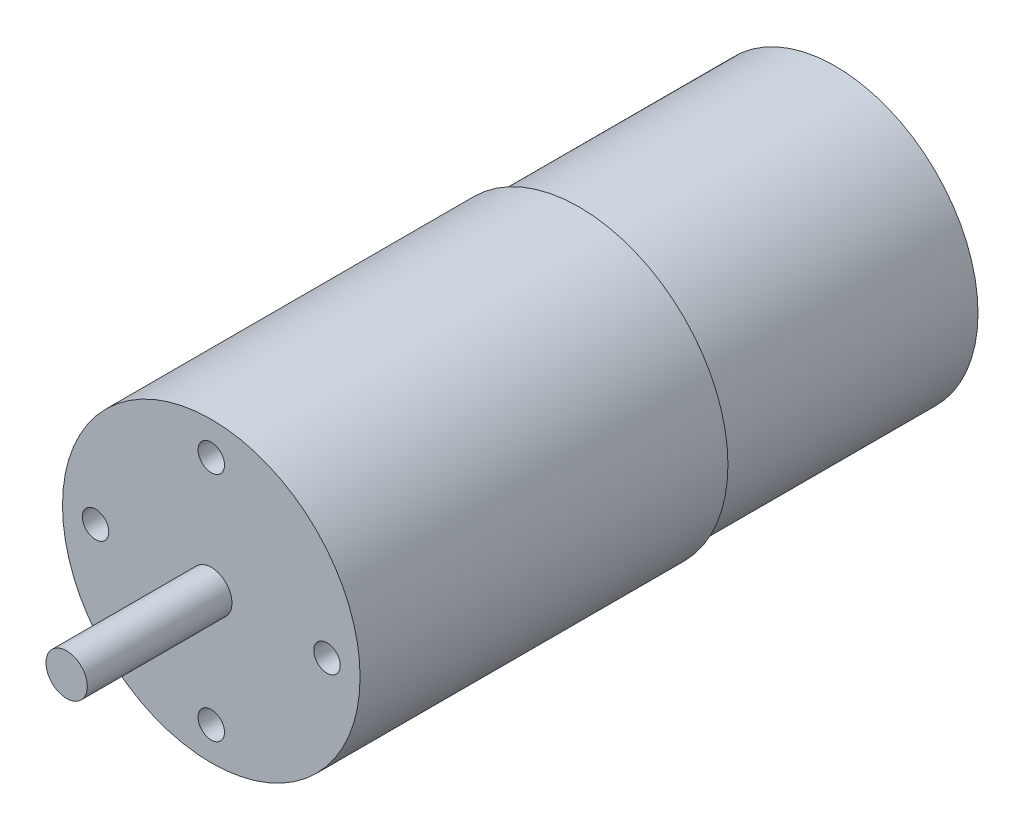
SolidWorks part; units mm, degrees
ref_plane "前视基准面" through (0, 0, 0) normal (0, 0, 1) x (1, 0, 0)
ref_plane "上视基准面" through (0, 0, 0) normal (0, 1, 0) x (1, 0, 0)
ref_plane "右视基准面" through (0, 0, 0) normal (1, 0, 0) x (0, 0, -1)
sketch "草图1" plane through (0, 0, 0) normal (0, 0, 1) x (1, 0, 0)
  circle A0 centre (0, 0) radius 17.25
  dimension "D1" = 34.5
extrude "凸台-拉伸1" add sketch "草图1" along normal blind 31
sketch "草图2" plane through (0, 0, 31) normal (0, 0, 1) x (1, 0, 0)
  circle A0 centre (0, 0) radius 18
  dimension "D1" = 36
extrude "凸台-拉伸2" add sketch "草图2" along normal blind 44.5
sketch "草图3" plane through (0, 0, 75.5) normal (0, 0, 1) x (1, 0, 0)
  circle A0 centre (0, 0) radius 2.5
  dimension "D1" = 5
extrude "凸台-拉伸3" add sketch "草图3" along normal blind 17.5
sketch "草图4" plane through (0, 0, 75.5) normal (0, 0, 1) x (1, 0, 0)
  line L0 (0, 0) -> (0, 14) construction
  circle A0 centre (0, 14) radius 1.6
  circle A1 centre (14, 0) radius 1.6
  circle A2 centre (0, -14) radius 1.6
  circle A3 centre (-14, 0) radius 1.6
  point P13 (0, 0)
  dimension "D2" = 3.2
  dimension "D1" = 14
  dimension "D3" = 4
extrude "切除-拉伸1" cut sketch "草图4" against normal blind 5
sketch "草图6" plane through (0, 0, 0) normal (0, 1, 0) x (1, 0, 0)
  line L0 (-11, 2) -> (-11, 0)
  line L1 (17.25, 0) -> (-17.25, 0) construction
  line L2 (-11, 0) -> (-9, 0)
  line L3 (-9, 0) -> (-9, 2)
  line L4 (0, 0) -> (0, -2.5303) construction
  line L5 (9, 0) -> (9, 2)
  line L6 (11, 0) -> (9, 0)
  line L7 (11, 2) -> (11, 0)
  arc A0 (-9, 2) -> (-11, 2) centre (-10, 2) ccw
  circle A1 centre (-10, 2) radius 0.75
  circle A2 centre (10, 2) radius 0.75
  arc A3 (9, 2) -> (11, 2) centre (10, 2) cw
  dimension "D1" = 2
  dimension "D4" = 1.5
  dimension "D2" = 10
  dimension "D3" = 2
extrude "凸台-拉伸4" add sketch "草图6" along normal mid plane 1
sketch "草图7" plane through (0, 0, 93) normal (0, 0, 1) x (1, 0, 0)
  circle A0 centre (0, 0) radius 2.5 construction
  circle A1 centre (0, 0) radius 2.5
